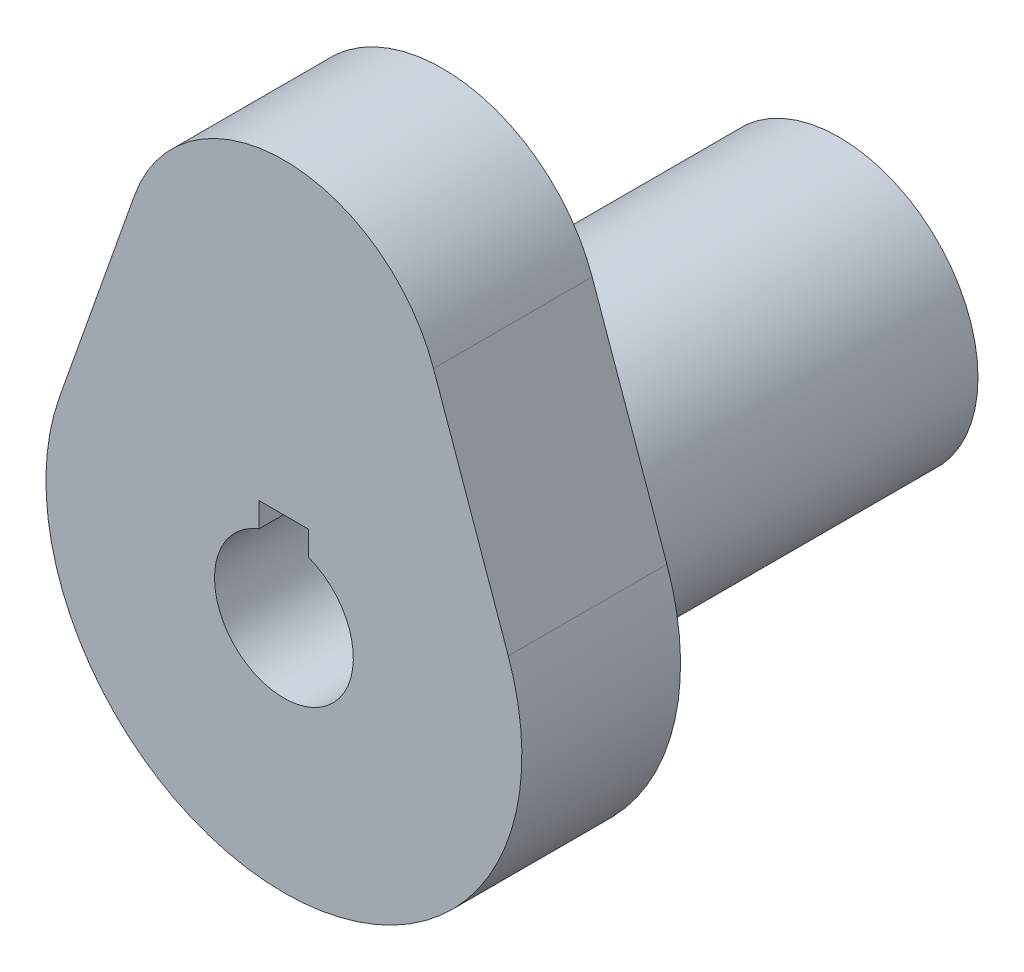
SolidWorks part; units mm, degrees
ref_plane "Front Plane" through (0, 0, 0) normal (0, 0, 1) x (1, 0, 0)
ref_plane "Top Plane" through (0, 0, 0) normal (0, 1, 0) x (1, 0, 0)
ref_plane "Right Plane" through (0, 0, 0) normal (1, 0, 0) x (0, 0, -1)
sketch "Sketch1" plane through (0, 0, 0) normal (0, 0, 1) x (1, 0, 0)
  line L2 (-287.3682, 101.6) -> (-191.5788, 372.5333)
  line L3 (287.3682, 101.6) -> (191.5788, 372.5333)
  circle A0 centre (0, 0) radius 88.9
  arc A1 (-287.3682, 101.6) -> (287.3682, 101.6) centre (0, 0) ccw
  arc A4 (191.5788, 372.5333) -> (-191.5788, 372.5333) centre (0, 304.8) ccw
  dimension "D1" = 177.8
  dimension "D2" = 304.8
  dimension "D3" = 203.2
  dimension "D6" = 304.8
extrude "Boss-Extrude1" add sketch "Sketch1" along normal blind 203.2
sketch "Sketch2" plane through (0, 0, 0) normal (0, 0, -1) x (-1, 0, 0)
  circle A0 centre (0, 0) radius 88.9 construction
  circle A1 centre (0, 0) radius 88.9
  circle A2 centre (0, 0) radius 177.8
  dimension "D1" = 355.6
extrude "Boss-Extrude2" add sketch "Sketch2" along normal blind 508
sketch "Sketch3" plane through (0, 0, 203.2) normal (0, 0, 1) x (1, 0, 0)
  line L0 (0, 0) -> (0, 139.9753) construction
  line L6 (-31.75, 114.3) -> (31.75, 114.3)
  line L7 (-31.75, 114.3) -> (-31.75, 83.037)
  line L9 (31.75, 114.3) -> (31.75, 83.037)
  circle A0 centre (0, 0) radius 88.9 construction
  arc A2 (31.75, 83.037) -> (-31.75, 83.037) centre (0, 0) ccw
  dimension "D3" = 63.5
  dimension "D4" = 114.3
extrude "Cut-Extrude1" cut sketch "Sketch3" against normal through all
